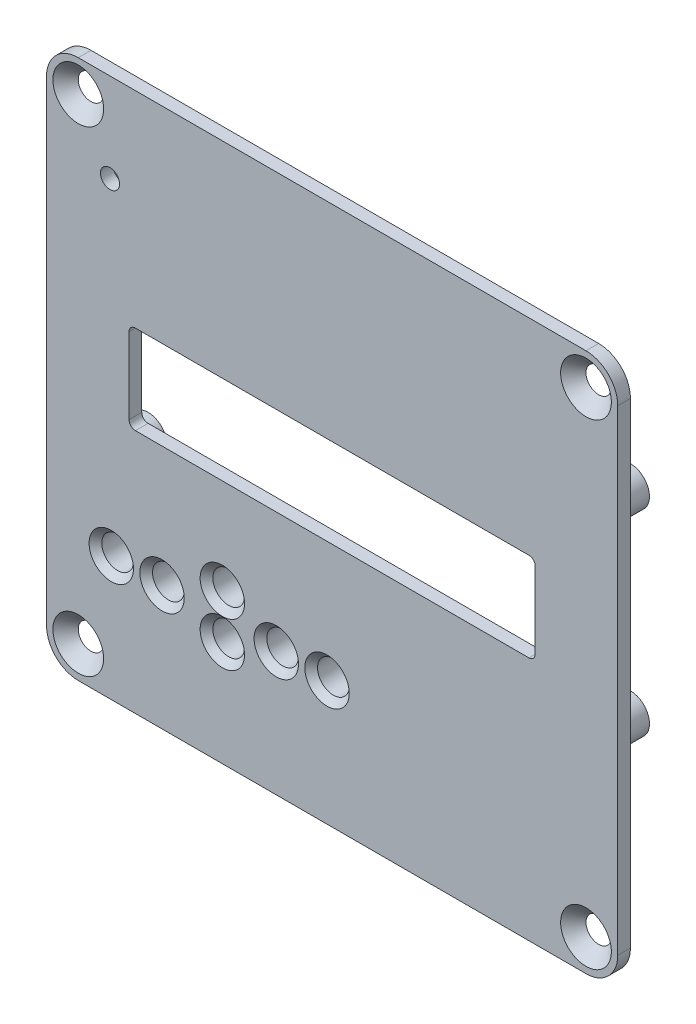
SolidWorks part; units mm, degrees
ref_plane "Спереди" through (0, 0, 0) normal (0, 0, 1) x (1, 0, 0)
ref_plane "Сверху" through (0, 0, 0) normal (0, 1, 0) x (1, 0, 0)
ref_plane "Справа" through (0, 0, 0) normal (1, 0, 0) x (0, 0, -1)
sketch "Эскиз1" plane through (0, 0, 0) normal (0, 0, 1) x (1, 0, 0)
  line L1 (-40, 42.5) -> (40, 42.5)
  line L2 (-45, 37.5) -> (-45, -37.5)
  line L3 (-40, -42.5) -> (40, -42.5)
  line L4 (45, 37.5) -> (45, -37.5)
  line L5 (-45, 42.5) -> (45, -42.5) construction
  line L6 (-45, -42.5) -> (45, 42.5) construction
  arc A0 (40, -42.5) -> (45, -37.5) centre (40, -37.5) ccw
  arc A1 (40, 42.5) -> (45, 37.5) centre (40, 37.5) cw
  arc A2 (-40, 42.5) -> (-45, 37.5) centre (-40, 37.5) ccw
  arc A3 (-45, -37.5) -> (-40, -42.5) centre (-40, -37.5) ccw
  point P0 (0, 0)
  dimension "D3" = 5
  dimension "D1" = 85
  dimension "D2" = 90
extrude "Бобышка-Вытянуть1" add sketch "Эскиз1" along normal blind 2
sketch "Эскиз2" plane through (0, 0, 2) normal (0, 0, 1) x (1, 0, 0)
  line L0 (-31, 10.1) -> (31, 10.1)
  line L1 (-32, 9.1) -> (-32, -2.9)
  line L2 (32, 9.1) -> (32, -2.9)
  line L3 (-31, -3.9) -> (31, -3.9)
  line L4 (-45, 37.5) -> (-45, -37.5) construction
  line L5 (40, 42.5) -> (-40, 42.5) construction
  line L6 (45, -37.5) -> (45, 37.5) construction
  line L7 (-40, -42.5) -> (40, -42.5) construction
  arc A0 (31, 10.1) -> (32, 9.1) centre (31, 9.1) cw
  arc A1 (-32, 9.1) -> (-31, 10.1) centre (-31, 9.1) cw
  arc A2 (31, -3.9) -> (32, -2.9) centre (31, -2.9) ccw
  arc A3 (-32, -2.9) -> (-31, -3.9) centre (-31, -2.9) ccw
  circle A8 centre (-35, 28.5) radius 1.5
  circle A9 centre (-34.8, -22.9) radius 2.5
  circle A10 centre (-26.8, -22.9) radius 2.5
  circle A11 centre (-17.3, -18.9) radius 2.5
  circle A12 centre (-17.3, -25.9) radius 2.5
  circle A13 centre (-8.8, -22.9) radius 2.5
  circle A14 centre (-0.8, -22.9) radius 2.5
  dimension "D1" = 3
  dimension "D2" = 10
  dimension "D3" = 5
  dimension "D9" = 1
  dimension "D4" = 14
  dimension "D5" = 13
  dimension "D6" = 13
  dimension "D7" = 32.4
  dimension "D8" = 38.6
  dimension "D10" = 10.2
  dimension "D11" = 19.6
  dimension "D12" = 18.2
  dimension "D13" = 19.6
  dimension "D14" = 27.7
  dimension "D15" = 23.6
  dimension "D16" = 27.7
  dimension "D17" = 16.6
  dimension "D18" = 36.2
  dimension "D19" = 19.6
  dimension "D20" = 44.2
  dimension "D21" = 19.6
extrude "Вырез-Вытянуть1" cut sketch "Эскиз2" against normal through all
sketch "Эскиз3" plane through (0, 0, 0) normal (0, 0, -1) x (-1, 0, 0)
  line L0 (-45, -37.5) -> (-45, 37.5) construction
  line L1 (-40, 42.5) -> (40, 42.5) construction
  line L2 (45, 37.5) -> (45, -37.5) construction
  line L3 (40, -42.5) -> (-40, -42.5) construction
  circle A0 centre (-38, 18.6) radius 3
  circle A1 centre (38, 18.6) radius 3
  circle A2 centre (38, -12.4) radius 3
  circle A3 centre (-38, -12.4) radius 3
  circle A4 centre (-38, 18.6) radius 1.25
  circle A5 centre (38, 18.6) radius 1.25
  circle A6 centre (38, -12.4) radius 1.25
  circle A7 centre (-38, -12.4) radius 1.25
  dimension "D1" = 6
  dimension "D2" = 2.5
  dimension "D3" = 7
  dimension "D4" = 23.9
  dimension "D5" = 23.9
  dimension "D6" = 7
  dimension "D7" = 7
  dimension "D8" = 30.1
  dimension "D9" = 7
  dimension "D10" = 30.1
extrude "Бобышка-Вытянуть2" add sketch "Эскиз3" along normal blind 7
fillet "Скругление1" radius 1 4 edges at (41, -12.4, 0) (-35, -12.4, 0) (-35, 18.6, 0) (41, 18.6, 0)
chamfer "Фаска1" distance 1 angle 45 6 edges at (1.7, -22.9, 2) (-6.3, -22.9, 2) (-14.8, -18.9, 2) (-14.8, -25.9, 2) (-24.3, -22.9, 2) (-32.3, -22.9, 2)
sketch "Эскиз4" plane through (0, 0, 2) normal (0, 0, 1) x (1, 0, 0)
  circle A0 centre (-40, 37.5) radius 2
  circle A1 centre (40, 37.5) radius 2
  circle A2 centre (40, -37.5) radius 2
  circle A3 centre (-40, -37.5) radius 2
  dimension "D1" = 4
extrude "Вырез-Вытянуть2" cut sketch "Эскиз4" against normal blind 2
chamfer "Фаска2" distance 2 angle 45 4 edges at (-38, -37.5, 2) (42, -37.5, 2) (42, 37.5, 2) (-38, 37.5, 2)
sketch "Эскиз5" plane through (0, 0, 0) normal (0, 0, -1) x (-1, 0, 0)
  circle A1 centre (0.8, -22.9) radius 3.4
  circle A3 centre (8.8, -22.9) radius 3.4
  circle A5 centre (17.3, -18.9) radius 3.4
  circle A6 centre (17.3, -25.9) radius 2.5
  circle A7 centre (17.3, -25.9) radius 3.4
  circle A8 centre (26.8, -22.9) radius 2.5
  circle A9 centre (26.8, -22.9) radius 3.4
  circle A10 centre (34.8, -22.9) radius 2.5
  circle A11 centre (34.8, -22.9) radius 3.4
  circle A12 centre (0.8, -22.9) radius 2.5
  circle A13 centre (8.8, -22.9) radius 2.5
  circle A14 centre (17.3, -18.9) radius 2.5
  circle A15 centre (0.8, -22.9) radius 2.5 construction
  circle A16 centre (8.8, -22.9) radius 2.5 construction
  circle A17 centre (17.3, -18.9) radius 2.5 construction
  circle A18 centre (17.3, -25.9) radius 2.5 construction
  circle A19 centre (26.8, -22.9) radius 2.5 construction
  circle A20 centre (34.8, -22.9) radius 2.5 construction
  dimension "D1" = 6.8
extrude "Бобышка-Вытянуть3" add sketch "Эскиз5" along normal blind 3
fillet "Скругление2" radius 1 6 edges at (-31.4, -22.9, 0) (-23.4, -22.9, 0) (-13.9, -25.9, 0) (-13.9, -18.9, 0) (-5.4, -22.9, 0) (2.6, -22.9, 0)
